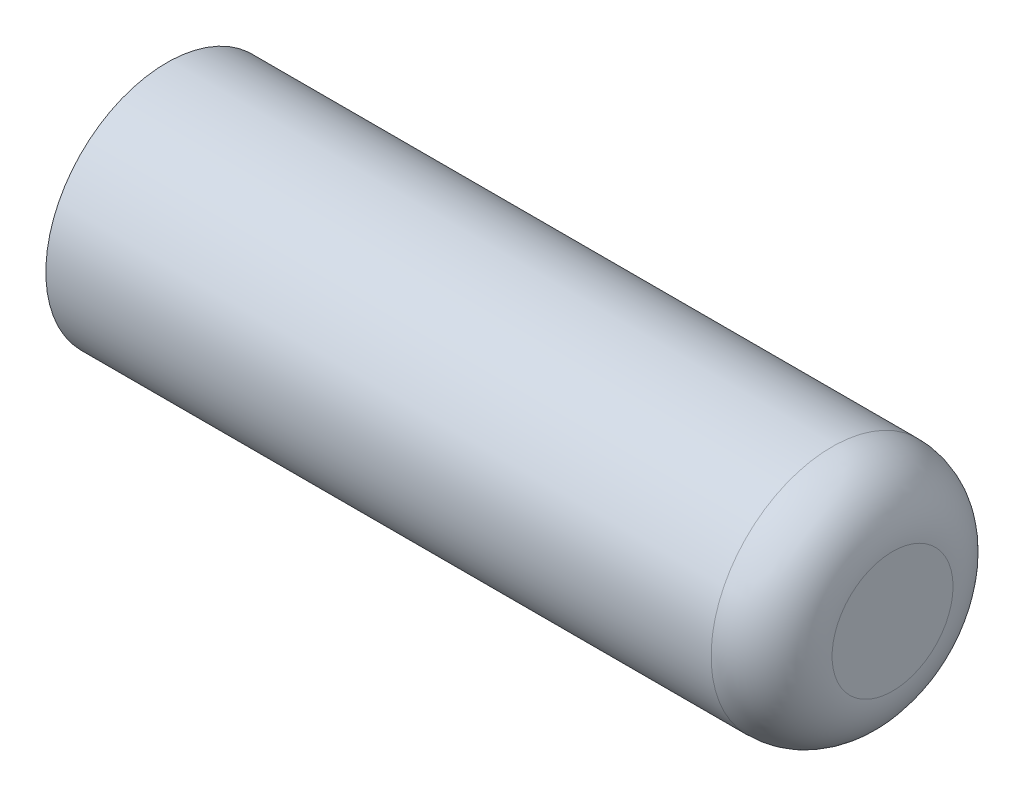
SolidWorks part; units mm, degrees
ref_plane "Front Plane" through (0, 0, 0) normal (0, 0, 1) x (1, 0, 0)
ref_plane "Top Plane" through (0, 0, 0) normal (0, 1, 0) x (1, 0, 0)
ref_plane "Right Plane" through (0, 0, 0) normal (1, 0, 0) x (0, 0, -1)
sketch "Sketch1" plane through (0, 0, 0) normal (1, 0, 0) x (0, 0, -1)
  circle A0 centre (0, 0) radius 5
  dimension "D1" = 10
extrude "Extrude1" add sketch "Sketch1" along normal blind 30
fillet "Fillet1" radius 2.5 1 edges at (30, 0, -5)
sketch "Sketch2" plane through (0, 0, 0) normal (-1, 0, 0) x (0, 0, 1)
  circle A0 centre (0, 0) radius 1.5
  dimension "D1" = 3
extrude "Extrude2" cut sketch "Sketch2" against normal blind 10
